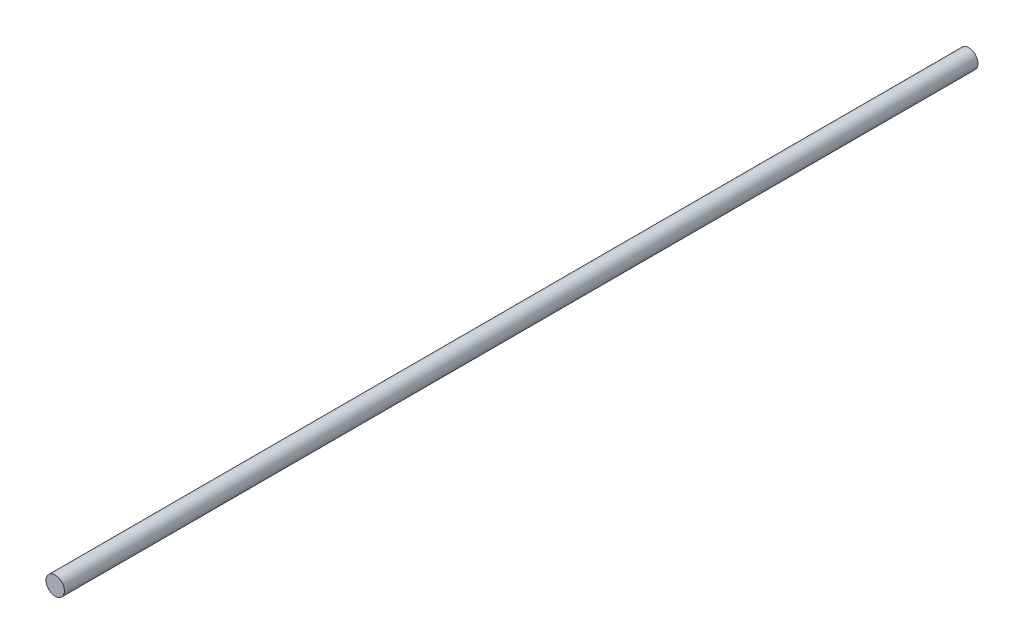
SolidWorks part; units mm, degrees
ref_plane "Front Plane" through (0, 0, 0) normal (0, 0, 1) x (1, 0, 0)
ref_plane "Top Plane" through (0, 0, 0) normal (0, 1, 0) x (1, 0, 0)
ref_plane "Right Plane" through (0, 0, 0) normal (1, 0, 0) x (0, 0, -1)
sketch "Sketch2" plane through (0, 0, 0) normal (0, 0, 1) x (1, 0, 0)
  circle A0 centre (0, 0) radius 0.9779
  dimension "D1" = 1.9558
extrude "Boss-Extrude1" add sketch "Sketch2" along normal blind 97
